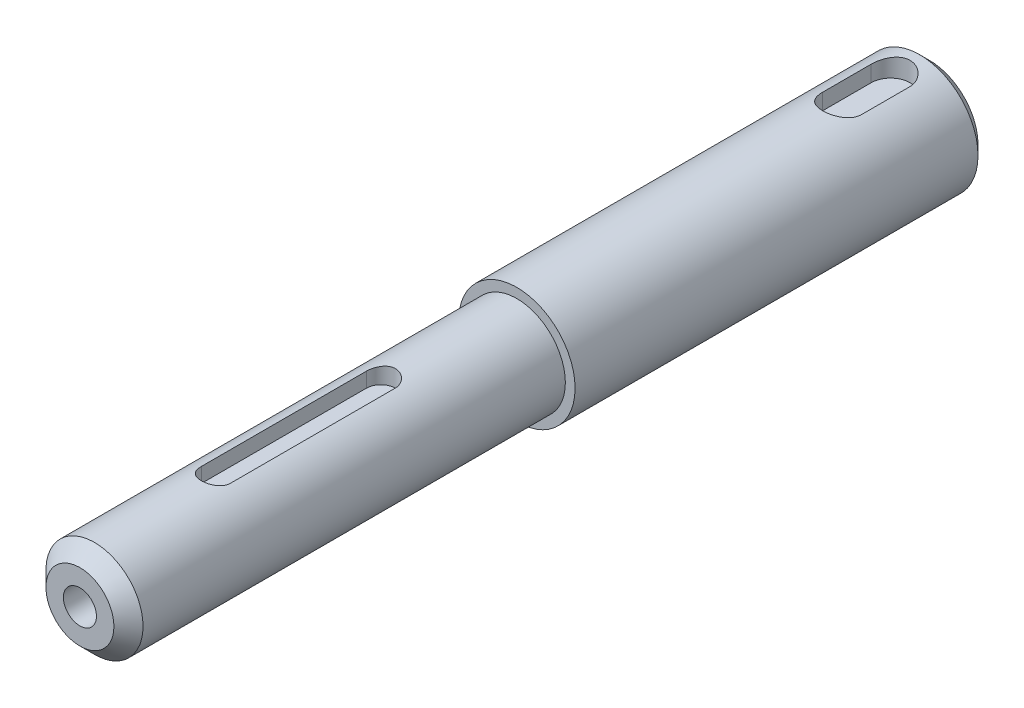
SolidWorks part; units mm, degrees
ref_plane "Face" through (0, 0, 0) normal (0, 0, 1) x (1, 0, 0)
ref_plane "Dessus" through (0, 0, 0) normal (0, 1, 0) x (1, 0, 0)
ref_plane "Droite" through (0, 0, 0) normal (1, 0, 0) x (0, 0, -1)
sketch "Esquisse1" plane through (0, 0, 0) normal (0, 0, 1) x (1, 0, 0)
  circle A0 centre (0, 0) radius 12
  dimension "D1" = 24
extrude "Base-Extrusion" add sketch "Esquisse1" along normal blind 85
sketch "Esquisse2" plane through (0, 0, 85) normal (0, 0, 1) x (1, 0, 0)
  circle A0 centre (0, 0) radius 10
  dimension "D1" = 20
extrude "Boss.-Extru.1" add sketch "Esquisse2" along normal blind 90
chamfer "Chanfrein1" distance 3 angle 45
chamfer "Chanfrein2" distance 2 angle 45
hole_wizard "Trou taraudé M8x1.25" positions "Esquisse4" profile "Esquisse3" tap size "M8x1.25" standard "ISO"
sketch "Esquisse4" plane through (0, 0, 175) normal (0, 0, 1) x (1, 0, 0)
  point P0 (0, 0)
sketch "Esquisse3" plane through (0, 0, 175) normal (1, 0, 0) x (0, -1, 0)
  line L0 (0, 0) -> (0, 24.0429)
  line L1 (0, 24.0429) -> (3.4, 22)
  line L2 (3.4, 22) -> (3.4, 0)
  line L5 (3.4, 0) -> (0, 0)
  line L10 (0, 24.0429) -> (-3.4, 22) construction
  line L11 (0, -6.35) -> (0, 107.95) construction
  dimension "Diamètre du perçage" = 6.8
  dimension "Profondeur du perçage" = 22
  dimension "Angle de pointe" = 118
ref_plane "Plan rainure1" through (0, 6.5, 0) normal (0, 1, 0) x (-1, 0, 0)
sketch "Esquisse5" plane through (0, 6.5, 0) normal (0, 1, 0) x (-1, 0, 0)
  line L0 (0, 85) -> (0, 2) construction
  line L1 (3, 147) -> (3, 113)
  line L2 (-3, 147) -> (-3, 113)
  line L3 (7, 175) -> (-7, 175) construction
  arc A0 (3, 147) -> (-3, 147) centre (0, 147) ccw
  arc A1 (-3, 113) -> (3, 113) centre (0, 113) ccw
  dimension "D1" = 3
  dimension "D2" = 28
  dimension "D3" = 34
extrude "Enlèv. mat.-Extru.1" cut sketch "Esquisse5" along normal through all
ref_plane "Plan rainure2" through (0, 8, 0) normal (0, 1, 0) x (-1, 0, 0)
sketch "Esquisse6" plane through (0, 8, 0) normal (0, 1, 0) x (-1, 0, 0)
  line L0 (0, 172) -> (0, 85) construction
  line L1 (4, 18) -> (4, 8)
  line L2 (-4, 18) -> (-4, 8)
  arc A0 (4, 18) -> (-4, 18) centre (0, 18) ccw
  arc A1 (-4, 8) -> (4, 8) centre (0, 8) ccw
  dimension "D1" = 4
  dimension "D2" = 10
  dimension "D3" = 8
extrude "Enlèv. mat.-Extru.2" cut sketch "Esquisse6" along normal through all
